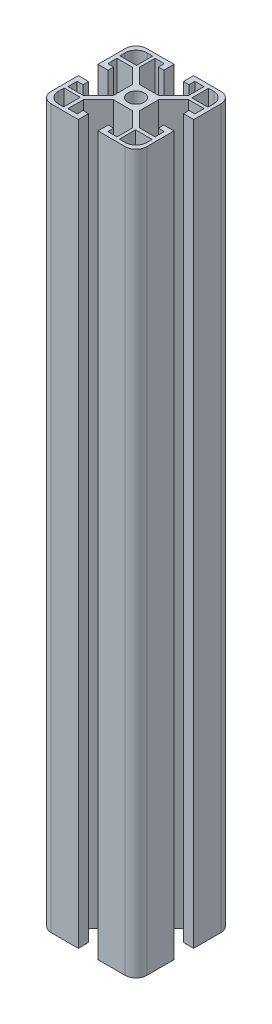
SolidWorks part; units mm, degrees
ref_plane "Front Plane" through (0, 0, 0) normal (0, 0, 1) x (1, 0, 0)
ref_plane "Top Plane" through (0, 0, 0) normal (0, 1, 0) x (1, 0, 0)
ref_plane "Right Plane" through (0, 0, 0) normal (1, 0, 0) x (0, 0, -1)
sketch "Sketch1" plane through (0, 0, 0) normal (0, 1, 0) x (1, 0, 0)
  line L1 (0, 0) -> (40, 0)
  line L2 (0, 0) -> (0, 40)
  line L3 (0, 40) -> (40, 40)
  line L4 (40, 0) -> (40, 40)
  dimension "D1" = 40
  dimension "D2" = 40
extrude "Boss-Extrude1" add sketch "Sketch1" along normal blind 300
sketch "Sketch2" plane through (0, 300, 0) normal (0, 1, 0) x (1, 0, 0)
  line L0 (30.25, 31.75) -> (24, 25.5)
  line L5 (30.25, 38.2) -> (30.25, 31.75)
  line L6 (26.4, 38.2) -> (30.25, 38.2)
  line L8 (26.4, 35.75) -> (26.4, 38.2)
  line L13 (24.1, 35.75) -> (26.4, 35.75)
  line L14 (24.1, 40) -> (24.1, 35.75)
  line L20 (40, 0) -> (40, 40) construction
  line L21 (31.75, 9.75) -> (25.5, 16)
  line L23 (0, 0) -> (40, 40) construction
  line L48 (38.2, 9.75) -> (31.75, 9.75)
  line L49 (38.2, 13.6) -> (38.2, 9.75)
  line L50 (35.75, 13.6) -> (38.2, 13.6)
  line L51 (35.75, 15.9) -> (35.75, 13.6)
  line L52 (40, 15.9) -> (35.75, 15.9)
  line L53 (40, 15.9) -> (40, 24.1)
  line L54 (40, 24.1) -> (35.75, 24.1)
  line L55 (35.75, 24.1) -> (35.75, 26.4)
  line L56 (24.1, 40) -> (15.9, 40)
  line L57 (40, 40) -> (0, 40) construction
  line L58 (15.9, 40) -> (15.9, 35.75)
  line L59 (15.9, 35.75) -> (13.6, 35.75)
  line L60 (13.6, 35.75) -> (13.6, 38.2)
  line L61 (13.6, 38.2) -> (9.75, 38.2)
  line L62 (9.75, 38.2) -> (9.75, 31.75)
  line L63 (9.75, 31.75) -> (16, 25.5)
  line L64 (16, 25.5) -> (24, 25.5)
  line L66 (0, 40) -> (0, 0) construction
  line L67 (8.45, 31.75) -> (1.5, 31.75)
  line L68 (8.45, 31.75) -> (8.45, 38.5)
  line L69 (8.45, 38.5) -> (1.5, 38.5)
  line L70 (1.5, 31.75) -> (1.5, 38.5)
  line L71 (35.75, 26.4) -> (38.2, 26.4)
  line L72 (38.2, 26.4) -> (38.2, 30.25)
  line L73 (38.2, 30.25) -> (31.75, 30.25)
  line L74 (31.75, 30.25) -> (25.5, 24)
  line L75 (25.5, 24) -> (25.5, 16)
  line L76 (31.75, 31.55) -> (31.75, 38.5)
  line L77 (31.75, 31.55) -> (38.5, 31.55)
  line L78 (38.5, 31.55) -> (38.5, 38.5)
  line L79 (31.75, 38.5) -> (38.5, 38.5)
  line L80 (9.75, 8.25) -> (16, 14.5)
  line L81 (9.75, 1.8) -> (9.75, 8.25)
  line L82 (13.6, 1.8) -> (9.75, 1.8)
  line L83 (13.6, 4.25) -> (13.6, 1.8)
  line L84 (15.9, 4.25) -> (13.6, 4.25)
  line L85 (15.9, 0) -> (15.9, 4.25)
  line L86 (15.9, 0) -> (24.1, 0)
  line L87 (24.1, 0) -> (24.1, 4.25)
  line L88 (24.1, 4.25) -> (26.4, 4.25)
  line L89 (26.4, 4.25) -> (26.4, 1.8)
  line L90 (26.4, 1.8) -> (30.25, 1.8)
  line L91 (30.25, 1.8) -> (30.25, 8.25)
  line L92 (30.25, 8.25) -> (24, 14.5)
  line L93 (24, 14.5) -> (16, 14.5)
  line L94 (31.55, 8.25) -> (38.5, 8.25)
  line L95 (31.55, 8.25) -> (31.55, 1.5)
  line L96 (31.55, 1.5) -> (38.5, 1.5)
  line L97 (38.5, 8.25) -> (38.5, 1.5)
  line L98 (8.25, 30.25) -> (14.5, 24)
  line L99 (1.8, 30.25) -> (8.25, 30.25)
  line L100 (1.8, 26.4) -> (1.8, 30.25)
  line L101 (4.25, 26.4) -> (1.8, 26.4)
  line L102 (4.25, 24.1) -> (4.25, 26.4)
  line L103 (0, 24.1) -> (4.25, 24.1)
  line L104 (0, 24.1) -> (0, 15.9)
  line L105 (0, 15.9) -> (4.25, 15.9)
  line L106 (4.25, 15.9) -> (4.25, 13.6)
  line L107 (4.25, 13.6) -> (1.8, 13.6)
  line L108 (1.8, 13.6) -> (1.8, 9.75)
  line L109 (1.8, 9.75) -> (8.25, 9.75)
  line L110 (8.25, 9.75) -> (14.5, 16)
  line L111 (14.5, 16) -> (14.5, 24)
  line L112 (8.25, 8.45) -> (8.25, 1.5)
  line L113 (8.25, 8.45) -> (1.5, 8.45)
  line L114 (1.5, 8.45) -> (1.5, 1.5)
  line L115 (8.25, 1.5) -> (1.5, 1.5)
  circle A0 centre (20, 20) radius 3.4
  point P26 (8.45, 35.125)
  point P47 (20, 20)
  point P89 (20, 20)
  dimension "D9" = 135
  dimension "D1" = 6.8
  dimension "D2" = 8.2
  dimension "D3" = 20.5
  dimension "D4" = 1.8
  dimension "D5" = 4.25
  dimension "D6" = 14.5
  dimension "D7" = 9.75
  dimension "D8" = 8.25
  dimension "D10" = 1.5
  dimension "D11" = 1.5
  dimension "D12" = 1.3
  dimension "D13" = 3.85
  dimension "D14" = 4.25
  dimension "D15" = 1.8
  dimension "D16" = 15.9
  dimension "D17" = 15.9
  dimension "D18" = 13.6
  dimension "D19" = 135
  dimension "D20" = 8.25
  dimension "D21" = 4
extrude "Cut-Extrude1" cut sketch "Sketch2" against normal through all
fillet "Fillet1" radius 4.5 8 edges at (1.5, 150, -1.5) (0, 150, 0) (1.5, 150, -38.5) (0, 150, -40) (38.5, 150, -38.5) (40, 150, -40) (40, 150, 0) (38.5, 150, -1.5)
